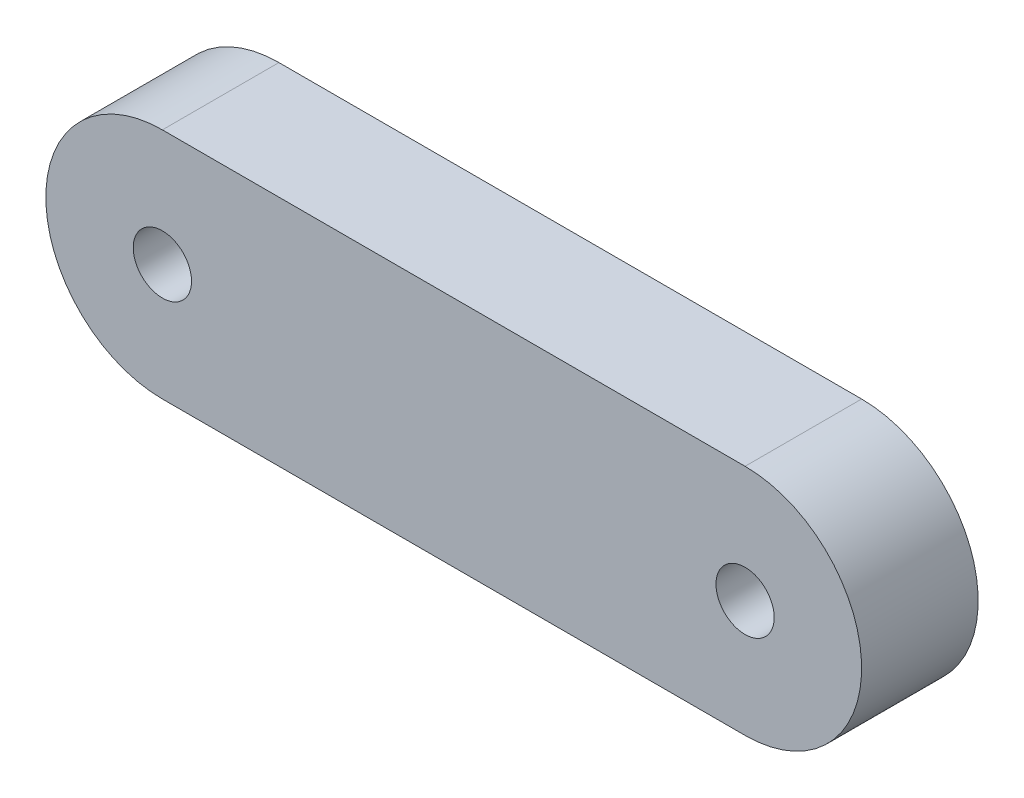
SolidWorks part; units mm, degrees
ref_plane "Front Plane" through (0, 0, 0) normal (0, 0, 1) x (1, 0, 0)
ref_plane "Top Plane" through (0, 0, 0) normal (0, 1, 0) x (1, 0, 0)
ref_plane "Right Plane" through (0, 0, 0) normal (1, 0, 0) x (0, 0, -1)
sketch "Sketch1" plane through (0, 0, 0) normal (0, 0, 1) x (1, 0, 0)
  line L0 (0, 0) -> (12.7, 0) construction
  line L1 (0, 2.54) -> (12.7, 2.54)
  line L2 (0, -2.54) -> (12.7, -2.54)
  arc A0 (0, 2.54) -> (0, -2.54) centre (0, 0) ccw
  arc A1 (12.7, -2.54) -> (12.7, 2.54) centre (12.7, 0) ccw
  point P3 (6.35, 0)
  dimension "D1" = 2.54
  dimension "D2" = 12.7
extrude "Boss-Extrude1" add sketch "Sketch1" along normal blind 2.54
sketch "Sketch2" plane through (0, 0, 2.54) normal (0, 0, 1) x (1, 0, 0)
  circle A0 centre (0, 0) radius 0.635
  dimension "D1" = 1.27
extrude "Cut-Extrude1" cut sketch "Sketch2" against normal through all both and the other way through all
ref_plane "Plane1" through (6.35, 0, 0) normal (1, 0, 0) x (0, 0, -1)
mirror "Mirror1" about plane through (6.35, 0, 0) normal (1, 0, 0) of "Cut-Extrude1"
